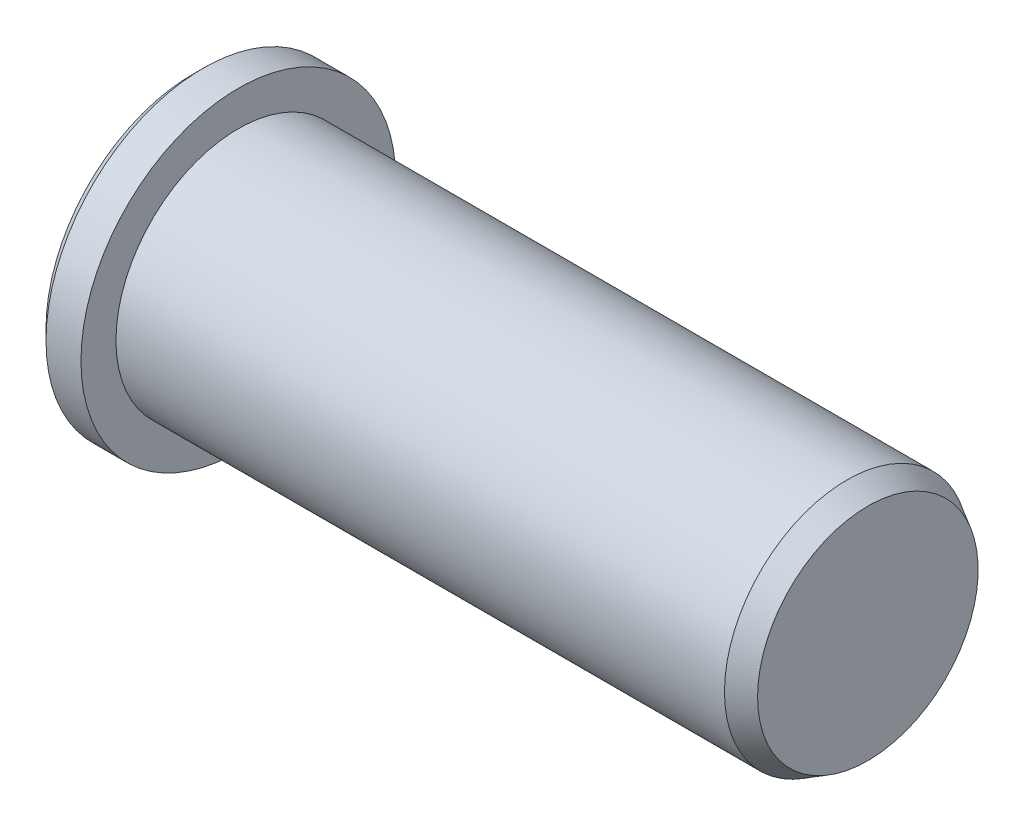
SolidWorks part; units mm, degrees
ref_plane "Front Plane" through (0, 0, 0) normal (0, 0, 1) x (1, 0, 0)
ref_plane "Top Plane" through (0, 0, 0) normal (0, 1, 0) x (1, 0, 0)
ref_plane "Right Plane" through (0, 0, 0) normal (1, 0, 0) x (0, 0, -1)
other "Configuration Table"
sketch "BodySke" plane through (0, 0, 0) normal (0, 0, 1) x (1, 0, 0)
  line L0 (0, 0) -> (231.5186, 0) construction
  line L1 (0, 0) -> (0, 42)
  line L2 (0, 42) -> (3, 45)
  line L3 (3, 45) -> (13, 45)
  line L4 (13, 45) -> (13, 35)
  line L5 (13, 35) -> (187, 35)
  line L6 (187, 35) -> (193, 31.5359)
  line L7 (193, 31.5359) -> (193, 0)
  line L8 (0, 0) -> (193, 0)
  circle A0 centre (177, 0) radius 6.5 construction
  dimension "Hole_dia" = 13
  dimension "Head_dia" = 90
  dimension "Head_height" = 13
  dimension "Diameter" = 70
  dimension "Chamfer_width" = 3
  dimension "Chamfer_angle" = 45
  dimension "Length" = 180
  dimension "End_chamfer_angle" = 30
  dimension "End_chamfer_width" = 6
  dimension "Hole_height" = 16
revolve "BaseBody" add sketch "BodySke" angle 360 about L0
sketch "HoleSke" plane through (0, 0, 0) normal (0, 0, 1) x (1, 0, 0)
  line L0 (0, 0) -> (194.6145, 0) construction
  line L1 (0, 42) -> (0, -42) construction
  line L2 (0, 0) -> (231.5186, 0) construction
  circle A0 centre (177, 0) radius 6.5 construction
  circle A1 centre (177, 0) radius 6.5
extrude "Hole" [suppressed] cut sketch "HoleSke" against normal through all and the other way through all
